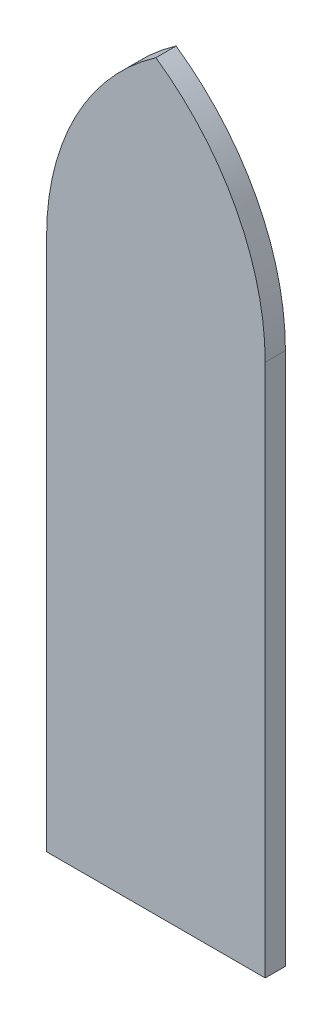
SolidWorks part; units mm, degrees
ref_plane "Plan de face" through (0, 0, 0) normal (0, 0, 1) x (1, 0, 0)
ref_plane "Plan de dessus" through (0, 0, 0) normal (0, 1, 0) x (1, 0, 0)
ref_plane "Plan de droite" through (0, 0, 0) normal (1, 0, 0) x (0, 0, -1)
sketch "Esquisse1" plane through (0, 0, 0) normal (0, 0, 1) x (1, 0, 0)
  line L1 (125, 0) -> (-125, 0)
  line L2 (125, 0) -> (125, 700)
  line L3 (125, 700) -> (-125, 700)
  line L4 (-125, 0) -> (-125, 700)
  dimension "D1" = 250
  dimension "D2" = 700
extrude "Boss.-Extru.1" add sketch "Esquisse1" along normal blind 15
sketch "Esquisse2" plane through (0, 0, 0) normal (0, 0, -1) x (-1, 0, 0)
  line L0 (81.1261, 0) -> (81.1261, 395.7949)
  line L1 (125, 0) -> (-125, 0) construction
  line L2 (-81.1261, 0) -> (-81.1261, 395.7949)
  line L6 (81.1261, 0) -> (125, 0)
  line L7 (125, 0) -> (125, 700)
  line L8 (125, 700) -> (-125, 700)
  line L9 (-125, 700) -> (-125, 0)
  line L10 (-125, 0) -> (-81.1261, 0)
  line L11 (-93.1261, -3) -> (-93.1261, -31) construction
  line L12 (93.1261, -3) -> (93.1261, -31) construction
  line L13 (-83.5, 395.7949) -> (-116.5, 395.7949) construction
  line L14 (-83.5, 395.7949) -> (-116.5, 395.7949) construction
  line L15 (8.25, 554.7106) -> (-8.25, 583.2894) construction
  line L16 (8.25, 554.7106) -> (-8.25, 583.2894) construction
  arc A0 (81.1261, 395.7949) -> (0, 551) centre (-107.9009, 395.7949) ccw
  arc A1 (-81.1261, 395.7949) -> (0, 551) centre (107.9009, 395.7949) cw
  point P30 (0, 569)
  dimension "D1" = 12
  dimension "D2" = 12
  dimension "D3" = 18
extrude "Enlèv. mat.-Extru.1" cut sketch "Esquisse2" against normal through all
